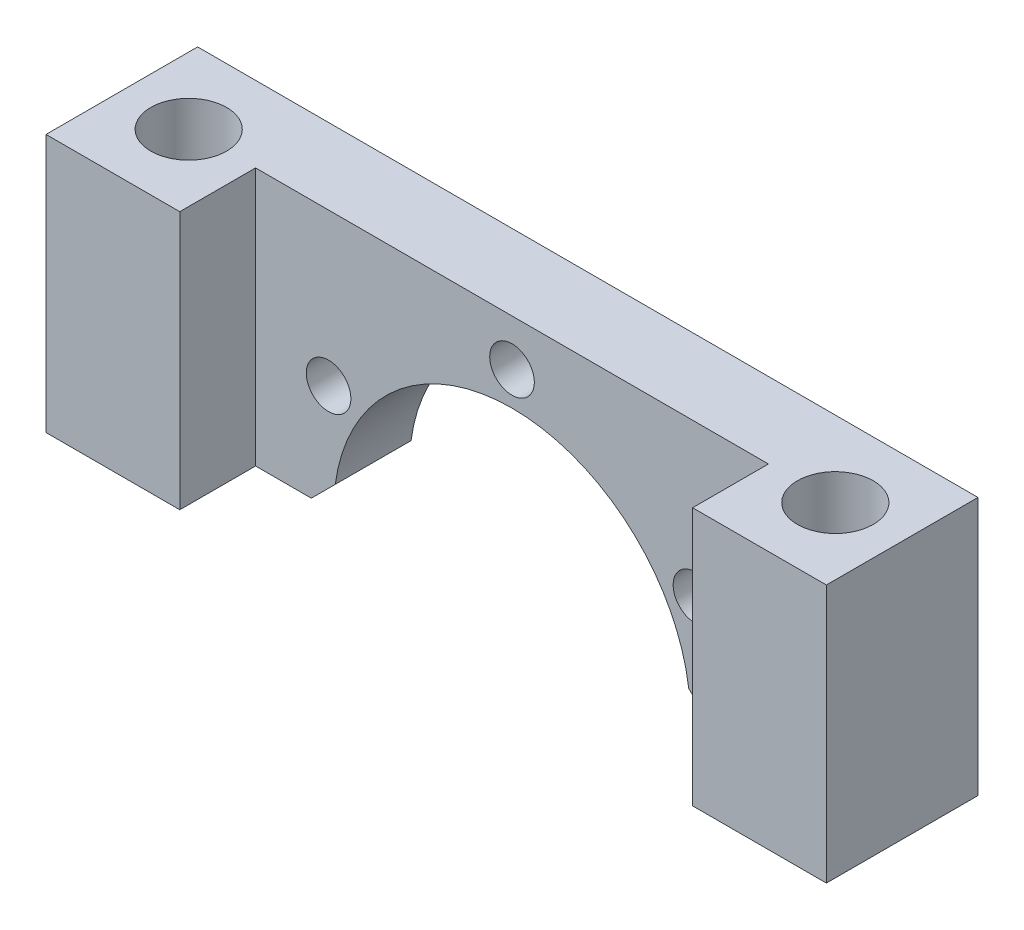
SolidWorks part; units mm, degrees
ref_plane "Front Plane" through (0, 0, 0) normal (0, 0, 1) x (1, 0, 0)
ref_plane "Top Plane" through (0, 0, 0) normal (0, 1, 0) x (1, 0, 0)
ref_plane "Right Plane" through (0, 0, 0) normal (1, 0, 0) x (0, 0, -1)
sketch "Sketch1" plane through (0, 0, 0) normal (0, 0, 1) x (1, 0, 0)
  line L0 (-8, 0) -> (-17.5, 0)
  line L1 (-17.5, 0) -> (-17.5, 11.58)
  line L2 (-17.5, 11.58) -> (17.5, 11.58)
  line L3 (17.5, 11.58) -> (17.5, 0)
  line L4 (17.5, 0) -> (8, 0)
  line L5 (0, 0) -> (0, 9.5) construction
  arc A0 (-8, 0) -> (8, 0) centre (0, 0) cw
  circle A1 centre (0, 0) radius 9.5 construction
  dimension "D1" = 8
  dimension "D2" = 9.5
  dimension "D3" = 9.5
  dimension "D4" = 9.5
  dimension "D5" = 11.58
extrude "Boss-Extrude1" add sketch "Sketch1" along normal blind 3.4
sketch "Sketch2" plane through (0, 0, 3.4) normal (0, 0, 1) x (1, 0, 0)
  line L0 (-17.5, 0) -> (-8, 0) construction
  line L1 (-17.5, 11.58) -> (-11.5, 11.58)
  line L2 (-17.5, 11.58) -> (-17.5, 0)
  line L3 (-17.5, 0) -> (-11.5, 0)
  line L4 (-11.5, 11.58) -> (-11.5, 0)
  line L5 (0, 0) -> (0, 11.58) construction
  line L6 (17.5, 11.58) -> (-17.5, 11.58) construction
  line L7 (17.5, 0) -> (11.5, 0)
  line L8 (17.5, 11.58) -> (17.5, 0)
  line L9 (17.5, 11.58) -> (11.5, 11.58)
  line L10 (11.5, 11.58) -> (11.5, 0)
  dimension "D1" = 6
extrude "Boss-Extrude2" add sketch "Sketch2" along normal blind 3.4
sketch "Sketch3" plane through (0, 11.58, 0) normal (0, 1, 0) x (1, 0, 0)
  line L0 (-11.5, -6.8) -> (-17.5, -6.8) construction
  line L1 (0, 0) -> (0, -3.4) construction
  line L2 (11.5, -3.4) -> (-11.5, -3.4) construction
  circle A0 centre (-14.5, -3.4) radius 1.7
  circle A1 centre (14.5, -3.4) radius 1.7
  point P7 (-14.5, -6.8)
  dimension "D1" = 3.4
sketch "Sketch4" plane through (0, 0, 0) normal (0, 0, -1) x (-1, 0, 0)
  line L0 (0, 0) -> (0, 9.5) construction
  line L1 (0, 0) -> (8.2272, 4.75) construction
  line L2 (0, 0) -> (-8.2272, 4.75) construction
  circle A0 centre (-8.2272, 4.75) radius 1
  circle A1 centre (0, 9.5) radius 1
  circle A2 centre (8.2272, 4.75) radius 1
  dimension "D4" = 2
  dimension "D1" = 9.5
  dimension "D2" = 9.5
  dimension "D3" = 60
chamfer "Chamfer1" distance 1 angle 45 2 edges at (-8, 0, 1.7) (8, 0, 1.7)
extrude "Cut-Extrude1" cut sketch "Sketch3" against normal through all
extrude "Cut-Extrude2" cut sketch "Sketch4" against normal through all
